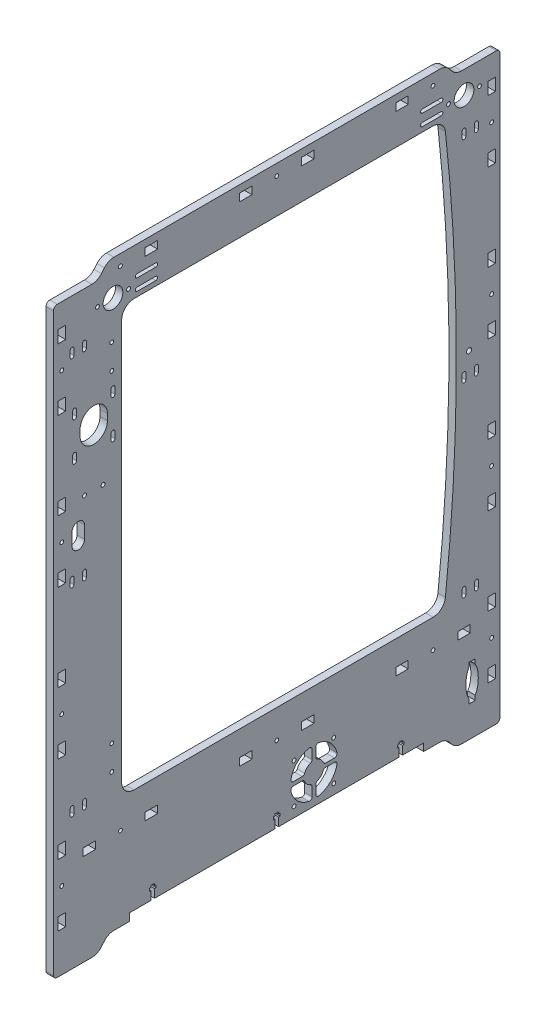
SolidWorks part; units mm, degrees
ref_plane "Спереди" through (0, 0, 0) normal (0, 0, 1) x (1, 0, 0)
ref_plane "Сверху" through (0, 0, 0) normal (0, 1, 0) x (1, 0, 0)
ref_plane "Справа" through (0, 0, 0) normal (1, 0, 0) x (0, 0, -1)
sketch "Эскиз1" plane through (0, 0, 0) normal (-1, 0, 0) x (0, -1, 0)
  line L0 (-471.1, 126) -> (-471.1, 0) construction
  line L1 (-32, -170.2) -> (-32, -176.3)
  line L2 (-42, -170.2) -> (-32, -170.2)
  line L3 (0, 0) -> (-558.4431, 0) construction
  line L4 (0, 0) -> (0, 200.825) construction
  line L5 (-77, 0) -> (-77, 159.0803) construction
  line L6 (-470, 173.25) -> (-422, 173.25) construction
  line L7 (-422, 173.25) -> (-422, 186.5928) construction
  line L8 (-452, 144.5) -> (-452, 119.5) construction
  line L9 (-392, 170.2) -> (-392, 176.3)
  line L10 (-402, 170.2) -> (-392, 170.2)
  line L11 (-402, 176.3) -> (-402, 170.2)
  line L12 (-392, 176.3) -> (-402, 176.3)
  line L13 (-332, 176.3) -> (-322, 176.3)
  line L14 (-332, 170.2) -> (-332, 176.3)
  line L15 (-322, 170.2) -> (-332, 170.2)
  line L16 (-322, 176.3) -> (-322, 170.2)
  line L17 (-282, 176.3) -> (-282, 170.2)
  line L18 (-272, 176.3) -> (-282, 176.3)
  line L19 (-282, 170.2) -> (-272, 170.2)
  line L20 (-272, 170.2) -> (-272, 176.3)
  line L21 (-212, 176.3) -> (-202, 176.3)
  line L22 (-212, 170.2) -> (-212, 176.3)
  line L23 (-202, 170.2) -> (-212, 170.2)
  line L24 (-202, 176.3) -> (-202, 170.2)
  line L25 (-162, 176.3) -> (-162, 170.2)
  line L26 (-152, 176.3) -> (-162, 176.3)
  line L27 (-162, 170.2) -> (-152, 170.2)
  line L28 (-152, 170.2) -> (-152, 176.3)
  line L29 (-452, -163.5) -> (-452, -138.5) construction
  line L30 (-473.5721, -141.3396) -> (-476.4279, -138.9433)
  line L31 (-470, -177) -> (-470, -149)
  line L32 (-3, -180) -> (-467, -180)
  line L33 (0, -149) -> (0, -177)
  line L34 (-6.4279, -138.9433) -> (-3.5721, -141.3396)
  line L35 (-474.15, -20) -> (-474.15, -30)
  line L36 (-468.05, -20) -> (-474.15, -20)
  line L37 (-468.05, -30) -> (-468.05, -20)
  line L38 (-474.15, -30) -> (-468.05, -30)
  line L39 (-452, 176.3) -> (-442, 176.3)
  line L40 (-442, 176.3) -> (-442, 170.2)
  line L41 (-442, 170.2) -> (-452, 170.2)
  line L42 (-452, 170.2) -> (-452, 176.3)
  line L43 (-468.05, -96) -> (-474.15, -96)
  line L44 (-468.05, -106) -> (-468.05, -96)
  line L45 (-474.15, -106) -> (-468.05, -106)
  line L46 (-474.15, -96) -> (-474.15, -106)
  line L47 (-80.05, -146) -> (-80.05, -156)
  line L48 (-73.95, -146) -> (-80.05, -146)
  line L49 (-73.95, -156) -> (-73.95, -146)
  line L50 (-80.05, -156) -> (-73.95, -156)
  line L51 (-73.95, -96) -> (-80.05, -96)
  line L52 (-73.95, -106) -> (-73.95, -96)
  line L53 (-80.05, -106) -> (-73.95, -106)
  line L54 (-80.05, -96) -> (-80.05, -106)
  line L55 (-80.05, -20) -> (-80.05, -30)
  line L56 (-73.95, -20) -> (-80.05, -20)
  line L57 (-73.95, -30) -> (-73.95, -20)
  line L58 (-80.05, -30) -> (-73.95, -30)
  line L59 (-452, -170.2) -> (-452, -176.3)
  line L60 (-442, -170.2) -> (-452, -170.2)
  line L61 (-442, -176.3) -> (-442, -170.2)
  line L62 (-452, -176.3) -> (-442, -176.3)
  line L63 (-152, -170.2) -> (-152, -176.3)
  line L64 (-162, -170.2) -> (-152, -170.2)
  line L65 (-152, -176.3) -> (-162, -176.3)
  line L66 (-162, -176.3) -> (-162, -170.2)
  line L67 (-202, -176.3) -> (-202, -170.2)
  line L68 (-202, -170.2) -> (-212, -170.2)
  line L69 (-212, -170.2) -> (-212, -176.3)
  line L70 (-212, -176.3) -> (-202, -176.3)
  line L71 (-272, -170.2) -> (-272, -176.3)
  line L72 (-282, -170.2) -> (-272, -170.2)
  line L73 (-272, -176.3) -> (-282, -176.3)
  line L74 (-282, -176.3) -> (-282, -170.2)
  line L75 (-80.05, 30) -> (-73.95, 30)
  line L76 (-73.95, 30) -> (-73.95, 20)
  line L77 (-73.95, 20) -> (-80.05, 20)
  line L78 (-80.05, 20) -> (-80.05, 30)
  line L79 (-80.05, 96) -> (-80.05, 106)
  line L80 (-80.05, 106) -> (-73.95, 106)
  line L81 (-73.95, 106) -> (-73.95, 96)
  line L82 (-73.95, 96) -> (-80.05, 96)
  line L83 (-80.05, 156) -> (-73.95, 156)
  line L84 (-73.95, 156) -> (-73.95, 146)
  line L85 (-73.95, 146) -> (-80.05, 146)
  line L86 (-80.05, 146) -> (-80.05, 156)
  line L87 (-474.15, 96) -> (-474.15, 106)
  line L88 (-474.15, 106) -> (-468.05, 106)
  line L89 (-468.05, 106) -> (-468.05, 96)
  line L90 (-468.05, 96) -> (-474.15, 96)
  line L91 (-322, -176.3) -> (-322, -170.2)
  line L92 (-322, -170.2) -> (-332, -170.2)
  line L93 (-332, -170.2) -> (-332, -176.3)
  line L94 (-332, -176.3) -> (-322, -176.3)
  line L95 (-474.15, 30) -> (-468.05, 30)
  line L96 (-468.05, 30) -> (-468.05, 20)
  line L97 (-468.05, 20) -> (-474.15, 20)
  line L98 (-474.15, 20) -> (-474.15, 30)
  line L99 (-392, -176.3) -> (-402, -176.3)
  line L100 (-402, -176.3) -> (-402, -170.2)
  line L101 (-402, -170.2) -> (-392, -170.2)
  line L102 (-392, -170.2) -> (-392, -176.3)
  line L103 (-92, 176.3) -> (-82, 176.3)
  line L104 (-92, 170.2) -> (-92, 176.3)
  line L105 (-82, 170.2) -> (-92, 170.2)
  line L106 (-82, 176.3) -> (-82, 170.2)
  line L107 (-10, -131.2829) -> (-10, 131.2829)
  line L108 (-6.4279, 138.9433) -> (-3.5721, 141.3396)
  line L109 (0, 149) -> (0, 177)
  line L110 (-3, 180) -> (-467, 180)
  line L111 (-470, 177) -> (-470, 149)
  line L112 (-473.5721, 141.3396) -> (-476.4279, 138.9433)
  line L113 (-480, 131.2829) -> (-480, -131.2829)
  line L114 (-42, 176.3) -> (-42, 170.2)
  line L115 (-32, 176.3) -> (-42, 176.3)
  line L116 (-42, 170.2) -> (-32, 170.2)
  line L117 (-32, 170.2) -> (-32, 176.3)
  line L118 (-32, -176.3) -> (-42, -176.3)
  line L119 (-42, -176.3) -> (-42, -170.2)
  line L120 (-82, -176.3) -> (-82, -170.2)
  line L121 (-82, -170.2) -> (-92, -170.2)
  line L122 (-92, -170.2) -> (-92, -176.3)
  line L123 (-92, -176.3) -> (-82, -176.3)
  circle A0 centre (-302, 173.25) radius 1.55
  circle A1 centre (-62, -173.25) radius 1.55
  circle A2 centre (-452, 132) radius 7.95
  circle A3 centre (-452, 119.5) radius 1.55
  circle A4 centre (-182, 173.25) radius 1.55
  circle A5 centre (-452, -163.5) radius 1.55
  circle A6 centre (-452, -138.5) radius 1.55
  circle A7 centre (-452, -151) radius 7.95
  circle A8 centre (-422, 173.25) radius 1.55
  arc A9 (-476.4279, -138.9433) -> (-480, -131.2829) centre (-470, -131.2829) cw
  arc A10 (-470, -149) -> (-473.5721, -141.3396) centre (-480, -149) ccw
  arc A11 (-467, -180) -> (-470, -177) centre (-467, -177) cw
  circle A12 centre (-77, 0) radius 1.55
  circle A13 centre (-77, 126) radius 1.55
  circle A14 centre (-471.1, 126) radius 1.55
  circle A15 centre (-471.1, 0) radius 1.55
  arc A16 (0, -177) -> (-3, -180) centre (-3, -177) cw
  arc A17 (-3.5721, -141.3396) -> (0, -149) centre (-10, -149) cw
  arc A18 (-10, -131.2829) -> (-6.4279, -138.9433) centre (0, -131.2829) ccw
  circle A19 centre (-471.1, -126) radius 1.55
  circle A20 centre (-77, -126) radius 1.55
  arc A21 (-10, 131.2829) -> (-6.4279, 138.9433) centre (0, 131.2829) cw
  arc A22 (-3.5721, 141.3396) -> (0, 149) centre (-10, 149) ccw
  arc A23 (0, 177) -> (-3, 180) centre (-3, 177) ccw
  arc A24 (-467, 180) -> (-470, 177) centre (-467, 177) ccw
  arc A25 (-470, 149) -> (-473.5721, 141.3396) centre (-480, 149) cw
  arc A26 (-476.4279, 138.9433) -> (-480, 131.2829) centre (-470, 131.2829) ccw
  circle A27 centre (-422, -173.25) radius 1.55
  circle A28 centre (-182, -173.25) radius 1.55
  circle A29 centre (-452, 144.5) radius 1.55
  circle A35 centre (-302, -173.25) radius 1.55
  circle A36 centre (-62, 173.25) radius 1.55
  point P0 (-471.1, 20)
  point P2 (-77, 20)
  point P11 (-442, 173.25)
  point P15 (-10, 0)
  point P17 (-452, -151)
  point P20 (-77, 146)
  point P173 (-452, 132)
  dimension "D2" = 10
  dimension "D5" = 3
  dimension "D10" = 3.1
  dimension "D15" = 252
  dimension "D20" = 151
  dimension "D21" = 283
  dimension "D25" = 4
  dimension "D26" = 120
  dimension "D24" = 18
  dimension "D29" = 15.9
  dimension "D1" = 360
  dimension "D3" = 50
  dimension "D4" = 31
  dimension "D6" = 10
  dimension "D7" = 480
  dimension "D8" = 10
  dimension "D9" = 8.9
  dimension "D11" = 40
  dimension "D12" = 10
  dimension "D13" = 6.1
  dimension "D14" = 76
  dimension "D16" = 77
  dimension "D17" = 6.75
  dimension "D18" = 58
  dimension "D19" = 40
  dimension "D22" = 25
  dimension "D23" = 40
extrude "Бобышка-Вытянуть1" add sketch "Эскиз1" against normal blind 6
sketch "Эскиз2" plane through (0, 0, 0) normal (-1, 0, 0) x (0, 0, 1)
  line L0 (-180, 467) -> (-180, 3) construction
  line L1 (-155, 54) -> (-160, 54)
  line L2 (-155, 54) -> (-155, 25)
  line L3 (-155, 25) -> (-160, 25)
  line L4 (-160, 54) -> (-160, 25)
  line L5 (-177, 0) -> (-149, 0) construction
  dimension "D1" = 5
  dimension "D2" = 20
  dimension "D3" = 29
  dimension "D4" = 25
extrude "Вырез-Вытянуть1" cut sketch "Эскиз2" against normal through all
sketch "Эскиз4" plane through (6, 0, 0) normal (1, 0, 0) x (0, 0, -1)
  line L0 (0, 480) -> (0, 0) construction
  line L1 (-131.2829, 480) -> (131.2829, 480) construction
  line L2 (-115, 443) -> (126.058, 443)
  line L4 (126.058, 100) -> (-115, 100)
  line L5 (-125, 433) -> (-125, 110)
  line L7 (-180, 3) -> (-180, 467) construction
  line L8 (-125, 271.5) -> (-1355.1637, 271.5) construction
  arc A0 (135.9991, 108.9161) -> (135.9991, 434.0839) centre (-1355.1637, 271.5) ccw
  arc A1 (135.9991, 108.9161) -> (126.058, 100) centre (126.058, 110) cw
  arc A2 (126.058, 443) -> (135.9991, 434.0839) centre (126.058, 433) cw
  arc A3 (-125, 110) -> (-115, 100) centre (-115, 110) ccw
  arc A4 (-125, 433) -> (-115, 443) centre (-115, 433) cw
  point P17 (135, 443)
  point P22 (-125, 443)
  dimension "D3" = 260
  dimension "D5" = 10
  dimension "D6" = 1500
  dimension "D1" = 55
  dimension "D2" = 37
  dimension "D4" = 100
extrude "Вырез-Вытянуть3" cut sketch "Эскиз4" against normal through all
sketch "Эскиз5" plane through (6, 0, 0) normal (1, 0, 0) x (0, 0, -1)
  line L0 (-147.5, 373.5) -> (-147.5, 368.5) construction
  line L1 (-136.5, 373.5) -> (-136.5, 368.5)
  line L2 (-158.5, 373.5) -> (-158.5, 368.5)
  line L3 (-177, 470) -> (-149, 470) construction
  line L4 (-163, 384) -> (-163, 389) construction
  line L5 (-163, 355.5) -> (-132, 355.5) construction
  line L6 (-163, 355.5) -> (-163, 386.5) construction
  line L7 (-163, 386.5) -> (-132, 386.5) construction
  line L8 (-132, 355.5) -> (-132, 386.5) construction
  line L9 (-163, 355.5) -> (-132, 386.5) construction
  line L10 (-163, 386.5) -> (-132, 355.5) construction
  line L11 (-164.55, 384) -> (-164.55, 389)
  line L12 (-161.45, 384) -> (-161.45, 389)
  line L13 (-132, 384) -> (-132, 389) construction
  line L14 (-133.55, 384) -> (-133.55, 389)
  line L15 (-130.45, 384) -> (-130.45, 389)
  line L16 (-163, 358) -> (-163, 353) construction
  line L17 (-161.45, 358) -> (-161.45, 353)
  line L18 (-164.55, 358) -> (-164.55, 353)
  line L19 (-132, 358) -> (-132, 353) construction
  line L20 (-130.45, 358) -> (-130.45, 353)
  line L21 (-133.55, 358) -> (-133.55, 353)
  line L22 (-180, 3) -> (-180, 467) construction
  arc A0 (-136.5, 373.5) -> (-158.5, 373.5) centre (-147.5, 373.5) ccw
  arc A1 (-158.5, 368.5) -> (-136.5, 368.5) centre (-147.5, 368.5) ccw
  arc A2 (-164.55, 384) -> (-161.45, 384) centre (-163, 384) ccw
  arc A3 (-161.45, 389) -> (-164.55, 389) centre (-163, 389) ccw
  arc A4 (-133.55, 384) -> (-130.45, 384) centre (-132, 384) ccw
  arc A5 (-130.45, 389) -> (-133.55, 389) centre (-132, 389) ccw
  arc A6 (-161.45, 358) -> (-164.55, 358) centre (-163, 358) ccw
  arc A7 (-164.55, 353) -> (-161.45, 353) centre (-163, 353) ccw
  arc A8 (-130.45, 358) -> (-133.55, 358) centre (-132, 358) ccw
  arc A9 (-133.55, 353) -> (-130.45, 353) centre (-132, 353) ccw
  point P2 (-147.5, 371)
  point P9 (-147.5, 371)
  point P16 (-163, 386.5)
  point P22 (-132, 386.5)
  point P29 (-163, 355.5)
  point P36 (-132, 355.5)
  dimension "D2" = 11
  dimension "D7" = 1.55
  dimension "D1" = 5
  dimension "D3" = 99
  dimension "D4" = 32.5
  dimension "D5" = 31
extrude "Вырез-Вытянуть4" cut sketch "Эскиз5" against normal through all
sketch "Эскиз7" plane through (6, 0, 0) normal (1, 0, 0) x (0, 0, -1)
  line L0 (0, 0) -> (0, 202.8121) construction
  line L1 (131.2829, 10) -> (-131.2829, 10) construction
  line L2 (-118.5, 10) -> (118.5, 10)
  line L3 (-118.5, 10) -> (-118.5, 16)
  line L4 (-118.5, 16) -> (118.5, 16)
  line L5 (118.5, 10) -> (118.5, 16)
  point P9 (0, 16)
  dimension "D1" = 237
  dimension "D2" = 6
extrude "Вырез-Вытянуть6" cut sketch "Эскиз7" against normal through all
sketch "Эскиз8" plane through (6, 0, 0) normal (1, 0, 0) x (0, 0, -1)
  line L0 (180, 467) -> (180, 3) construction
  line L1 (14, 24) -> (46, 24) construction
  line L2 (14, 24) -> (14, 56) construction
  line L3 (14, 56) -> (46, 56) construction
  line L4 (46, 24) -> (46, 56) construction
  line L5 (14, 24) -> (46, 56) construction
  line L6 (14, 56) -> (46, 24) construction
  line L7 (28.5, 58.9407) -> (28.5, 47.8581)
  line L8 (31.5, 58.9407) -> (31.5, 47.8581)
  line L9 (30, 64.4649) -> (30, 40) construction
  line L10 (30, 40) -> (58.9291, 40) construction
  line L11 (48.9407, 41.5) -> (37.8581, 41.5)
  line L12 (48.9407, 38.5) -> (37.8581, 38.5)
  line L13 (31.5, 21.0593) -> (31.5, 32.1419)
  line L14 (28.5, 21.0593) -> (28.5, 32.1419)
  line L15 (11.0593, 38.5) -> (22.1419, 38.5)
  line L16 (11.0593, 41.5) -> (22.1419, 41.5)
  arc A0 (28.5, 58.9407) -> (11.0593, 41.5) centre (30, 40) ccw
  circle A1 centre (14, 56) radius 1.55
  circle A2 centre (46, 56) radius 1.55
  circle A3 centre (46, 24) radius 1.55
  circle A4 centre (14, 24) radius 1.55
  arc A5 (28.5, 47.8581) -> (22.1419, 41.5) centre (30, 40) ccw
  arc A6 (31.5, 32.1419) -> (37.8581, 38.5) centre (30, 40) ccw
  arc A7 (31.5, 21.0593) -> (48.9407, 38.5) centre (30, 40) ccw
  arc A8 (37.8581, 41.5) -> (31.5, 47.8581) centre (30, 40) ccw
  arc A9 (48.9407, 41.5) -> (31.5, 58.9407) centre (30, 40) ccw
  arc A10 (22.1419, 38.5) -> (28.5, 32.1419) centre (30, 40) ccw
  arc A11 (11.0593, 38.5) -> (28.5, 21.0593) centre (30, 40) ccw
  point P28 (30, 40)
  dimension "D1" = 3.1
  dimension "D3" = 38
  dimension "D6" = 3
  dimension "D8" = 4
  dimension "D7" = 8
  dimension "D2" = 32
  dimension "D4" = 40
  dimension "D5" = 150
extrude "Вырез-Вытянуть7" cut sketch "Эскиз8" against normal through all
fillet "Скругление2" radius 2 16 edges at (3, 21.0593, -31.5) (3, 47.8581, -28.5) (3, 47.8581, -31.5) (3, 41.5, -37.8581) (3, 41.5, -11.0593) (3, 41.5, -48.9407) (3, 41.5, -22.1419) (3, 38.5, -37.8581) (3, 32.1419, -31.5) (3, 58.9407, -31.5) (3, 38.5, -11.0593) (3, 58.9407, -28.5) (3, 38.5, -48.9407) (3, 38.5, -22.1419) (3, 32.1419, -28.5) (3, 21.0593, -28.5)
sketch "Эскиз9" plane through (6, 0, 0) normal (1, 0, 0) x (0, 0, -1)
  line L0 (-160, 305) -> (-160, 295) construction
  line L1 (-155, 305) -> (-155, 295)
  line L2 (-165, 305) -> (-165, 295)
  line L3 (-180, 3) -> (-180, 467) construction
  line L4 (-177, 470) -> (-149, 470) construction
  arc A0 (-155, 305) -> (-165, 305) centre (-160, 305) ccw
  arc A1 (-165, 295) -> (-155, 295) centre (-160, 295) ccw
  point P2 (-160, 300)
  dimension "D1" = 5
  dimension "D2" = 10
  dimension "D3" = 20
  dimension "D4" = 170
extrude "Вырез-Вытянуть8" cut sketch "Эскиз9" against normal through all
sketch "Эскиз10" plane through (6, 0, 0) normal (1, 0, 0) x (0, 0, -1)
  line L0 (0, 0) -> (0, 161.8793) construction
  line L1 (-1.5, 16) -> (1.5, 16)
  line L2 (118.5, 16) -> (-118.5, 16) construction
  line L3 (1.5, 16) -> (1.5, 22.8)
  line L4 (1.5, 22.8) -> (2.75, 22.8)
  line L5 (2.75, 22.8) -> (2.75, 25)
  line L6 (2.75, 25) -> (1.5, 25)
  line L7 (1.5, 25) -> (1.5, 26.5)
  line L8 (1.5, 26.5) -> (-1.5, 26.5)
  line L9 (-1.5, 25) -> (-1.5, 26.5)
  line L10 (-2.75, 25) -> (-1.5, 25)
  line L11 (-2.75, 22.8) -> (-2.75, 25)
  line L12 (-1.5, 22.8) -> (-2.75, 22.8)
  line L13 (-1.5, 16) -> (-1.5, 22.8)
  line L14 (101.5, 26.5) -> (98.5, 26.5)
  line L15 (101.5, 25) -> (101.5, 26.5)
  line L16 (102.75, 25) -> (101.5, 25)
  line L17 (102.75, 22.8) -> (102.75, 25)
  line L18 (101.5, 22.8) -> (102.75, 22.8)
  line L19 (101.5, 16) -> (101.5, 22.8)
  line L20 (98.5, 25) -> (98.5, 26.5)
  line L21 (97.25, 25) -> (98.5, 25)
  line L22 (97.25, 22.8) -> (97.25, 25)
  line L23 (98.5, 22.8) -> (97.25, 22.8)
  line L24 (98.5, 16) -> (98.5, 22.8)
  line L25 (98.5, 16) -> (101.5, 16)
  line L26 (-98.5, 16) -> (-101.5, 16)
  line L27 (-98.5, 16) -> (-98.5, 22.8)
  line L28 (-98.5, 22.8) -> (-97.25, 22.8)
  line L29 (-97.25, 22.8) -> (-97.25, 25)
  line L30 (-97.25, 25) -> (-98.5, 25)
  line L31 (-98.5, 25) -> (-98.5, 26.5)
  line L32 (-101.5, 16) -> (-101.5, 22.8)
  line L33 (-101.5, 22.8) -> (-102.75, 22.8)
  line L34 (-102.75, 22.8) -> (-102.75, 25)
  line L35 (-102.75, 25) -> (-101.5, 25)
  line L36 (-101.5, 25) -> (-101.5, 26.5)
  line L37 (-101.5, 26.5) -> (-98.5, 26.5)
  point P14 (0, 26.5)
  point P19 (0, 16)
  dimension "D1" = 3
  dimension "D2" = 5.5
  dimension "D3" = 1.5
  dimension "D4" = 2.2
  dimension "D5" = 10.5
  dimension "D7" = 100
  dimension "D6" = 2
extrude "Вырез-Вытянуть9" cut sketch "Эскиз10" against normal through all
sketch "Эскиз11" plane through (6, 0, 0) normal (1, 0, 0) x (0, 0, -1)
  line L0 (-180, 453) -> (-74.762, 453) construction
  line L1 (-112.5, 457.7) -> (-97.5, 457.7) construction
  line L2 (-112.5, 459.2) -> (-97.5, 459.2)
  line L3 (-112.5, 456.2) -> (-97.5, 456.2)
  line L4 (-112.5, 448.3) -> (-97.5, 448.3) construction
  line L5 (-112.5, 446.8) -> (-97.5, 446.8)
  line L6 (-112.5, 449.8) -> (-97.5, 449.8)
  line L7 (-180, 3) -> (-180, 467) construction
  line L8 (-131.2829, 480) -> (131.2829, 480) construction
  line L9 (10, 276.5227) -> (10, 509.3355) construction
  line L11 (132.5, 448.3) -> (117.5, 448.3) construction
  line L12 (132.5, 446.8) -> (117.5, 446.8)
  line L13 (132.5, 449.8) -> (117.5, 449.8)
  line L14 (132.5, 457.7) -> (117.5, 457.7) construction
  line L15 (132.5, 459.2) -> (117.5, 459.2)
  line L16 (132.5, 456.2) -> (117.5, 456.2)
  arc A0 (-112.5, 459.2) -> (-112.5, 456.2) centre (-112.5, 457.7) ccw
  arc A1 (-97.5, 456.2) -> (-97.5, 459.2) centre (-97.5, 457.7) ccw
  arc A2 (-112.5, 446.8) -> (-112.5, 449.8) centre (-112.5, 448.3) cw
  arc A3 (-97.5, 449.8) -> (-97.5, 446.8) centre (-97.5, 448.3) cw
  arc A4 (132.5, 446.8) -> (132.5, 449.8) centre (132.5, 448.3) ccw
  arc A5 (117.5, 449.8) -> (117.5, 446.8) centre (117.5, 448.3) ccw
  arc A6 (132.5, 459.2) -> (132.5, 456.2) centre (132.5, 457.7) cw
  arc A7 (117.5, 456.2) -> (117.5, 459.2) centre (117.5, 457.7) cw
  point P4 (-105, 457.7)
  point P11 (-105, 448.3)
  point P26 (125, 448.3)
  point P33 (125, 457.7)
  dimension "D1" = 1.5
  dimension "D2" = 9.4
  dimension "D3" = 15
  dimension "D4" = 75
  dimension "D5" = 27
  dimension "D6" = 190
extrude "Вырез-Вытянуть10" cut sketch "Эскиз11" against normal through all
sketch "Эскиз12" plane through (6, 0, 0) normal (1, 0, 0) x (0, 0, -1)
  line L0 (156, -15.1563) -> (156, 513.9573) construction
  line L1 (151, 427.5) -> (151, 422.5) construction
  line L2 (152.5, 427.5) -> (152.5, 422.5)
  line L3 (149.5, 427.5) -> (149.5, 422.5)
  line L4 (180, 467) -> (180, 3) construction
  line L5 (-131.2829, 480) -> (131.2829, 480) construction
  line L6 (161, 427.5) -> (161, 422.5) construction
  line L7 (159.5, 427.5) -> (159.5, 422.5)
  line L8 (162.5, 427.5) -> (162.5, 422.5)
  line L9 (151, 257.5) -> (151, 252.5) construction
  line L10 (152.5, 257.5) -> (152.5, 252.5)
  line L11 (149.5, 257.5) -> (149.5, 252.5)
  line L12 (161, 257.5) -> (161, 252.5) construction
  line L13 (159.5, 257.5) -> (159.5, 252.5)
  line L14 (162.5, 257.5) -> (162.5, 252.5)
  line L15 (151, 107.5) -> (151, 102.5) construction
  line L16 (152.5, 107.5) -> (152.5, 102.5)
  line L17 (149.5, 107.5) -> (149.5, 102.5)
  line L18 (161, 107.5) -> (161, 102.5) construction
  line L19 (159.5, 107.5) -> (159.5, 102.5)
  line L20 (162.5, 107.5) -> (162.5, 102.5)
  arc A0 (152.5, 427.5) -> (149.5, 427.5) centre (151, 427.5) ccw
  arc A1 (149.5, 422.5) -> (152.5, 422.5) centre (151, 422.5) ccw
  arc A2 (159.5, 427.5) -> (162.5, 427.5) centre (161, 427.5) cw
  arc A3 (162.5, 422.5) -> (159.5, 422.5) centre (161, 422.5) cw
  arc A4 (152.5, 257.5) -> (149.5, 257.5) centre (151, 257.5) ccw
  arc A5 (149.5, 252.5) -> (152.5, 252.5) centre (151, 252.5) ccw
  arc A6 (159.5, 257.5) -> (162.5, 257.5) centre (161, 257.5) cw
  arc A7 (162.5, 252.5) -> (159.5, 252.5) centre (161, 252.5) cw
  arc A8 (152.5, 107.5) -> (149.5, 107.5) centre (151, 107.5) ccw
  arc A9 (149.5, 102.5) -> (152.5, 102.5) centre (151, 102.5) ccw
  arc A10 (159.5, 107.5) -> (162.5, 107.5) centre (161, 107.5) cw
  arc A11 (162.5, 102.5) -> (159.5, 102.5) centre (161, 102.5) cw
  point P4 (151, 425)
  point P15 (161, 425)
  point P24 (151, 255)
  point P31 (161, 255)
  point P38 (151, 105)
  point P45 (161, 105)
  dimension "D2" = 1.5
  dimension "D1" = 5
  dimension "D3" = 10
  dimension "D4" = 24
  dimension "D5" = 55
  dimension "D7" = 170
  dimension "D6" = 150
extrude "Вырез-Вытянуть11" cut sketch "Эскиз12" against normal through all
sketch "Эскиз13" plane through (6, 0, 0) normal (1, 0, 0) x (0, 0, -1)
  line L0 (-160, 499.4465) -> (-160, 15.0326) construction
  line L1 (-165, 432.5) -> (-165, 427.5) construction
  line L2 (-163.5, 432.5) -> (-163.5, 427.5)
  line L3 (-166.5, 432.5) -> (-166.5, 427.5)
  line L4 (-180, 3) -> (-180, 467) construction
  line L5 (-131.2829, 480) -> (131.2829, 480) construction
  line L6 (-155, 432.5) -> (-155, 427.5) construction
  line L7 (-156.5, 432.5) -> (-156.5, 427.5)
  line L8 (-153.5, 432.5) -> (-153.5, 427.5)
  line L9 (-165, 272.5) -> (-165, 267.5) construction
  line L10 (-163.5, 272.5) -> (-163.5, 267.5)
  line L11 (-166.5, 272.5) -> (-166.5, 267.5)
  line L12 (-155, 272.5) -> (-155, 267.5) construction
  line L13 (-156.5, 272.5) -> (-156.5, 267.5)
  line L14 (-153.5, 272.5) -> (-153.5, 267.5)
  line L15 (-165, 112.5) -> (-165, 107.5) construction
  line L16 (-163.5, 112.5) -> (-163.5, 107.5)
  line L17 (-166.5, 112.5) -> (-166.5, 107.5)
  line L18 (-155, 112.5) -> (-155, 107.5) construction
  line L19 (-156.5, 112.5) -> (-156.5, 107.5)
  line L20 (-153.5, 112.5) -> (-153.5, 107.5)
  arc A0 (-163.5, 432.5) -> (-166.5, 432.5) centre (-165, 432.5) ccw
  arc A1 (-166.5, 427.5) -> (-163.5, 427.5) centre (-165, 427.5) ccw
  arc A2 (-163.5, 272.5) -> (-166.5, 272.5) centre (-165, 272.5) ccw
  arc A3 (-166.5, 267.5) -> (-163.5, 267.5) centre (-165, 267.5) ccw
  arc A4 (-156.5, 432.5) -> (-153.5, 432.5) centre (-155, 432.5) cw
  arc A5 (-153.5, 427.5) -> (-156.5, 427.5) centre (-155, 427.5) cw
  arc A6 (-156.5, 272.5) -> (-153.5, 272.5) centre (-155, 272.5) cw
  arc A7 (-153.5, 267.5) -> (-156.5, 267.5) centre (-155, 267.5) cw
  arc A8 (-163.5, 112.5) -> (-166.5, 112.5) centre (-165, 112.5) ccw
  arc A9 (-166.5, 107.5) -> (-163.5, 107.5) centre (-165, 107.5) ccw
  arc A10 (-156.5, 112.5) -> (-153.5, 112.5) centre (-155, 112.5) cw
  arc A11 (-153.5, 107.5) -> (-156.5, 107.5) centre (-155, 107.5) cw
  point P4 (-165, 430)
  point P19 (-155, 430)
  point P24 (-165, 270)
  point P31 (-155, 270)
  point P38 (-165, 110)
  point P45 (-155, 110)
  dimension "D3" = 1.5
  dimension "D4" = 20
  dimension "D6" = 3
  dimension "D1" = 10
  dimension "D2" = 5
  dimension "D5" = 50
extrude "Вырез-Вытянуть12" cut sketch "Эскиз13" against normal through all
sketch "Эскиз14" plane through (6, 0, 0) normal (1, 0, 0) x (0, 0, -1)
  line L0 (157.5, 54) -> (157.5, 25) construction
  line L1 (155, 54) -> (160, 54) construction
  line L2 (160, 25) -> (155, 25) construction
  ellipse E0 centre (157.5, 39.5) end of major axis (157.5, 27) minor radius 5
  dimension "D1" = 10
  dimension "D2" = 25
extrude "Вырез-Вытянуть13" cut sketch "Эскиз14" against normal through all
sketch "Эскиз15" plane through (6, 0, 0) normal (1, 0, 0) x (0, 0, -1)
  line L0 (-147.5, 384.5) -> (-147.5, 323.2971) construction
  line L1 (-133.55, 358) -> (-133.55, 353) construction
  arc A0 (-136.5, 373.5) -> (-158.5, 373.5) centre (-147.5, 373.5) ccw construction
  circle A1 centre (-140, 325.5) radius 1.6
  circle A2 centre (-155, 325.5) radius 1.6
  point P10 (-133.55, 355.5)
  dimension "D1" = 15
  dimension "D2" = 30
  dimension "D3" = 3.2
extrude "Вырез-Вытянуть14" cut sketch "Эскиз15" against normal through all
sketch "Эскиз16" plane through (6, 0, 0) normal (1, 0, 0) x (0, 0, -1)
  line L0 (-133, 421.5) -> (-133, 401.5) construction
  line L1 (-125, 271.5) -> (229.8933, 271.5) construction
  line L2 (-125, 433) -> (-125, 110) construction
  line L4 (-133, 121.5) -> (-133, 141.5) construction
  circle A0 centre (-133, 421.5) radius 1.55
  circle A1 centre (-133, 401.5) radius 1.55
  circle A2 centre (-133, 141.5) radius 1.55
  circle A3 centre (-133, 121.5) radius 1.55
  circle A4 centre (155, 271.5) radius 2.05
  point P8 (-133, 411.5)
  dimension "D1" = 3.1
  dimension "D5" = 280
  dimension "D6" = 4.1
  dimension "D2" = 20
  dimension "D3" = 140
  dimension "D4" = 8
extrude "Вырез-Вытянуть15" cut sketch "Эскиз16" against normal through all
